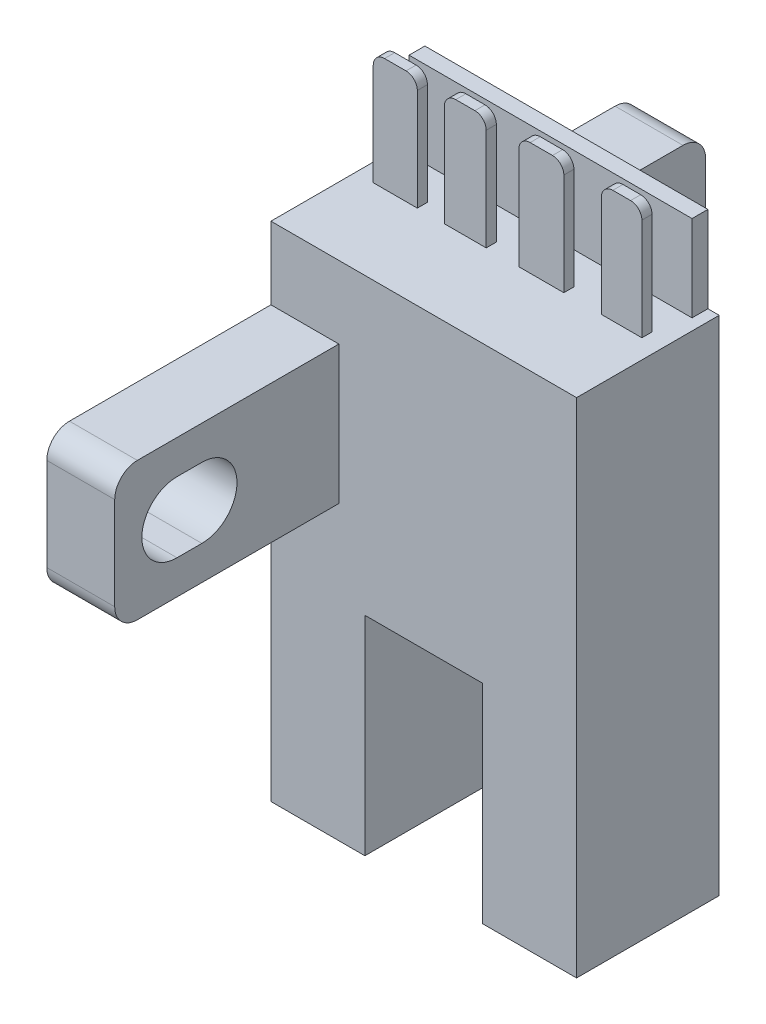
SolidWorks part; units mm, degrees
ref_plane "前视基准面" through (0, 0, 0) normal (0, 0, 1) x (1, 0, 0)
ref_plane "上视基准面" through (0, 0, 0) normal (0, 1, 0) x (1, 0, 0)
ref_plane "右视基准面" through (0, 0, 0) normal (1, 0, 0) x (0, 0, -1)
sketch "草图1" plane through (0, 0, 0) normal (0, 0, 1) x (1, 0, 0)
  line L1 (-6.75, -11.1) -> (6.75, -11.1)
  line L2 (-6.75, -11.1) -> (-6.75, 11.1)
  line L3 (-6.75, 11.1) -> (6.75, 11.1)
  line L4 (6.75, -11.1) -> (6.75, 11.1)
  line L5 (-6.75, -11.1) -> (6.75, 11.1) construction
  line L6 (-6.75, 11.1) -> (6.75, -11.1) construction
  point P0 (0, 0)
  dimension "D1" = 13.5
  dimension "D2" = 22.2
extrude "凸台-拉伸1" add sketch "草图1" along normal blind 6.3
sketch "草图2" plane through (0, 0, 0) normal (0, 0, 1) x (1, 0, 0)
  line L1 (6.75, 11.1) -> (-6.75, 11.1) construction
  line L2 (-6.25, 11.1) -> (6.25, 11.1)
  line L3 (-6.25, 11.1) -> (-6.25, 14.9)
  line L4 (-6.25, 14.9) -> (6.25, 14.9)
  line L5 (6.25, 11.1) -> (6.25, 14.9)
  line L6 (-6.75, 11.1) -> (-6.75, -11.1) construction
  line L7 (6.75, -11.1) -> (6.75, 11.1) construction
  dimension "D1" = 3.8
  dimension "D2" = 0.5
  dimension "D3" = 0.5
extrude "凸台-拉伸2" add sketch "草图2" along normal blind 0.7
sketch "草图3" plane through (0, 0, 0) normal (0, 0, -1) x (-1, 0, 0)
  line L0 (0, 0) -> (0, 50000) construction
  line L1 (6.75, -11.1) -> (-6.75, -11.1) construction
  line L2 (-2.6, -11.1) -> (2.6, -11.1)
  line L3 (-2.6, -11.1) -> (-2.6, -1.9)
  line L4 (-2.6, -1.9) -> (2.6, -1.9)
  line L5 (2.6, -11.1) -> (2.6, -1.9)
  dimension "D1" = 5.2
  dimension "D2" = 9.2
extrude "切除-拉伸1" cut sketch "草图3" against normal blind 6.3
sketch "草图5" plane through (-6.75, 0, 0) normal (-1, 0, 0) x (0, 0, 1)
  line L0 (6.3, -11.1) -> (0, -11.1) construction
  line L1 (-9.9, 7.9) -> (16.2, 7.9)
  line L2 (-9.9, 7.9) -> (-9.9, 1.8)
  line L3 (-9.9, 1.8) -> (16.2, 1.8)
  line L4 (16.2, 7.9) -> (16.2, 1.8)
  line L5 (3.15, -11.1) -> (3.15, 49988.9) construction
  line L6 (-9.9, 4.85) -> (49990.1, 4.85) construction
  line L7 (-7.15, 4.85) -> (-6.05, 4.85) construction
  line L8 (-7.15, 6.4) -> (-6.05, 6.4)
  line L9 (-7.15, 3.3) -> (-6.05, 3.3)
  line L10 (13.45, 4.85) -> (12.35, 4.85) construction
  line L11 (13.45, 6.4) -> (12.35, 6.4)
  line L12 (13.45, 3.3) -> (12.35, 3.3)
  arc A0 (-7.15, 6.4) -> (-7.15, 3.3) centre (-7.15, 4.85) ccw
  arc A1 (-6.05, 3.3) -> (-6.05, 6.4) centre (-6.05, 4.85) ccw
  arc A2 (13.45, 6.4) -> (13.45, 3.3) centre (13.45, 4.85) cw
  arc A3 (12.35, 3.3) -> (12.35, 6.4) centre (12.35, 4.85) cw
  point P8 (3.15, -11.1)
  point P11 (-9.9, 4.85)
  point P14 (-6.6, 4.85)
  point P21 (12.9, 4.85)
  dimension "D4" = 1.1
  dimension "D1" = 19
  dimension "D2" = 6.1
  dimension "D3" = 26.1
  dimension "D5" = 3.1
  dimension "D6" = 2.75
extrude "凸台-拉伸4" add sketch "草图5" against normal blind 3
sketch "草图7" plane through (0, 0, 0) normal (0, 0, -1) x (-1, 0, 0)
  text T0 "OMRON" font "宋体" height 2.5
sketch "草图8" plane through (0, 11.1, 0) normal (0, 1, 0) x (1, 0, 0)
  line L1 (-5.9624, -2.1226) -> (-4.0151, -2.1226)
  line L2 (-5.9624, -2.1226) -> (-5.9624, -2.5688)
  line L3 (-5.9624, -2.5688) -> (-4.0151, -2.5688)
  line L4 (-4.0151, -2.1226) -> (-4.0151, -2.5688)
  line L5 (-2.8183, -2.1226) -> (-0.9725, -2.1226)
  line L6 (-2.8183, -2.1226) -> (-2.8183, -2.5688)
  line L7 (-2.8183, -2.5688) -> (-0.9725, -2.5688)
  line L8 (-0.9725, -2.1226) -> (-0.9725, -2.5688)
  line L9 (0.4677, -2.1226) -> (2.4556, -2.1226)
  line L10 (0.4677, -2.1226) -> (0.4677, -2.5688)
  line L11 (0.4677, -2.5688) -> (2.4556, -2.5688)
  line L12 (2.4556, -2.1226) -> (2.4556, -2.5688)
  line L13 (4.1189, -2.1226) -> (5.9039, -2.1226)
  line L14 (4.1189, -2.1226) -> (4.1189, -2.5688)
  line L15 (4.1189, -2.5688) -> (5.9039, -2.5688)
  line L16 (5.9039, -2.1226) -> (5.9039, -2.5688)
extrude "凸台-拉伸6" add sketch "草图8" along normal blind 5
fillet "圆角1" radius 1 4 edges at (-5.25, 7.9, -9.9) (-5.25, 1.8, -9.9) (-5.25, 1.8, 16.2) (-5.25, 7.9, 16.2)
extrude "切除-拉伸2" cut sketch "草图7" against normal blind 0.1
fillet "圆角2" radius 0.5 8 edges at (-2.8183, 16.1, 2.3457) (4.1189, 16.1, 2.3457) (0.4677, 16.1, 2.3457) (-5.9624, 16.1, 2.3457) (-4.0151, 16.1, 2.3457) (-0.9725, 16.1, 2.3457) (2.4556, 16.1, 2.3457) (5.9039, 16.1, 2.3457)
